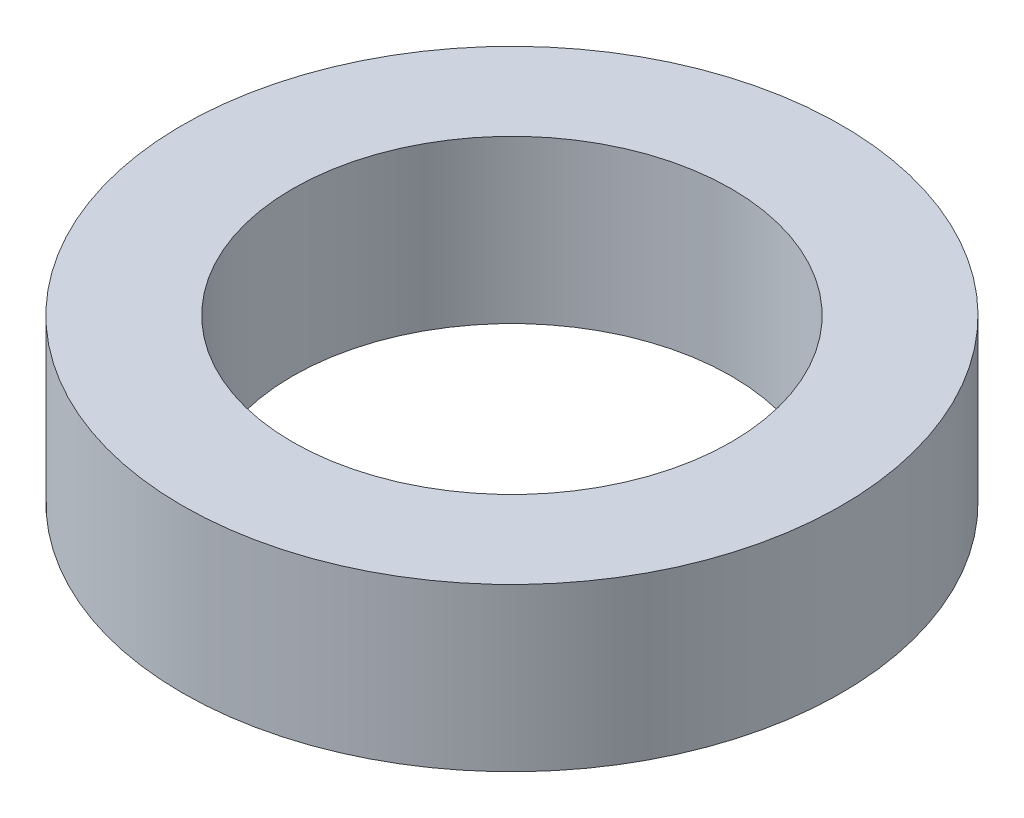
SolidWorks part; units mm, degrees
ref_plane "Front Plane" through (0, 0, 0) normal (0, 0, 1) x (1, 0, 0)
ref_plane "Top Plane" through (0, 0, 0) normal (0, 1, 0) x (1, 0, 0)
ref_plane "Right Plane" through (0, 0, 0) normal (1, 0, 0) x (0, 0, -1)
sketch "Sketch2" plane through (0, 0, 0) normal (0, 1, 0) x (1, 0, 0)
  circle A0 centre (0, 0) radius 2.032
  dimension "D1" = 4.064
extrude "Boss-Extrude1" add sketch "Sketch2" along normal blind 1 contours A0
sketch "Sketch3" plane through (0, 1, 0) normal (0, 1, 0) x (1, 0, 0)
  circle A0 centre (0, 0) radius 1.0922
  dimension "D1" = 2.1844
hole_wizard "#2 Clearance Hole1" positions "Sketch5" profile "Sketch4" hole size "#2" standard "ANSI Inch"
sketch "Sketch5" plane through (0, 1, 0) normal (0, 1, 0) x (1, 0, 0)
  point P0 (0, 0)
sketch "Sketch4" plane through (0, 1, 0) normal (1, 0, 0) x (0, 0, 1)
  line L0 (0, 0) -> (0, 1)
  line L1 (0, 1) -> (1.3525, 1)
  line L2 (1.3525, 1) -> (1.3525, 0)
  line L5 (1.3525, 0) -> (0, 0)
  line L11 (0, -6.35) -> (0, 107.95) construction
  dimension "Thru Hole Dia." = 2.7051
  dimension "Thru Hole Depth" = 1
